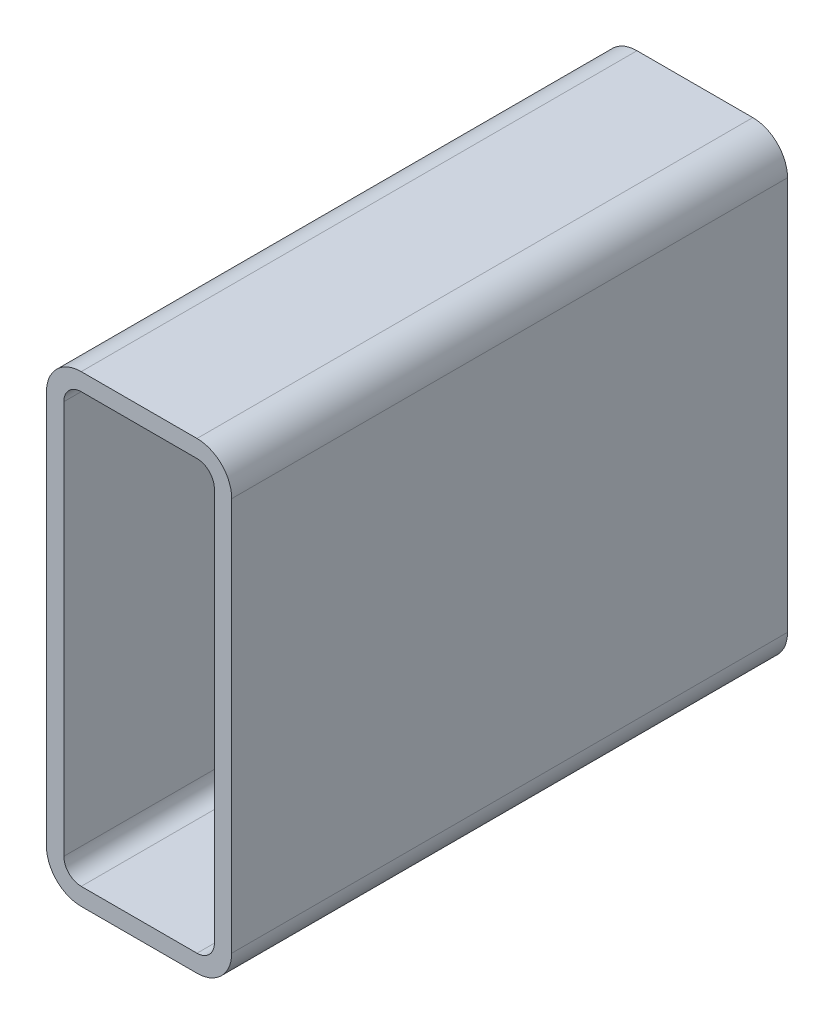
SolidWorks part; units mm, degrees
ref_plane "Front Plane" through (0, 0, 0) normal (0, 0, 1) x (1, 0, 0)
ref_plane "Top Plane" through (0, 0, 0) normal (0, 1, 0) x (1, 0, 0)
ref_plane "Right Plane" through (0, 0, 0) normal (1, 0, 0) x (0, 0, -1)
sketch "Sketch1" plane through (0, 0, 0) normal (0, 0, 1) x (1, 0, 0)
sketch_block_instance "HSS10x4x0.375-1"
sketch_block "HSS10x4x0.375"
extrude "Boss-Extrude1" add sketch "Sketch1" along normal blind 304.8
